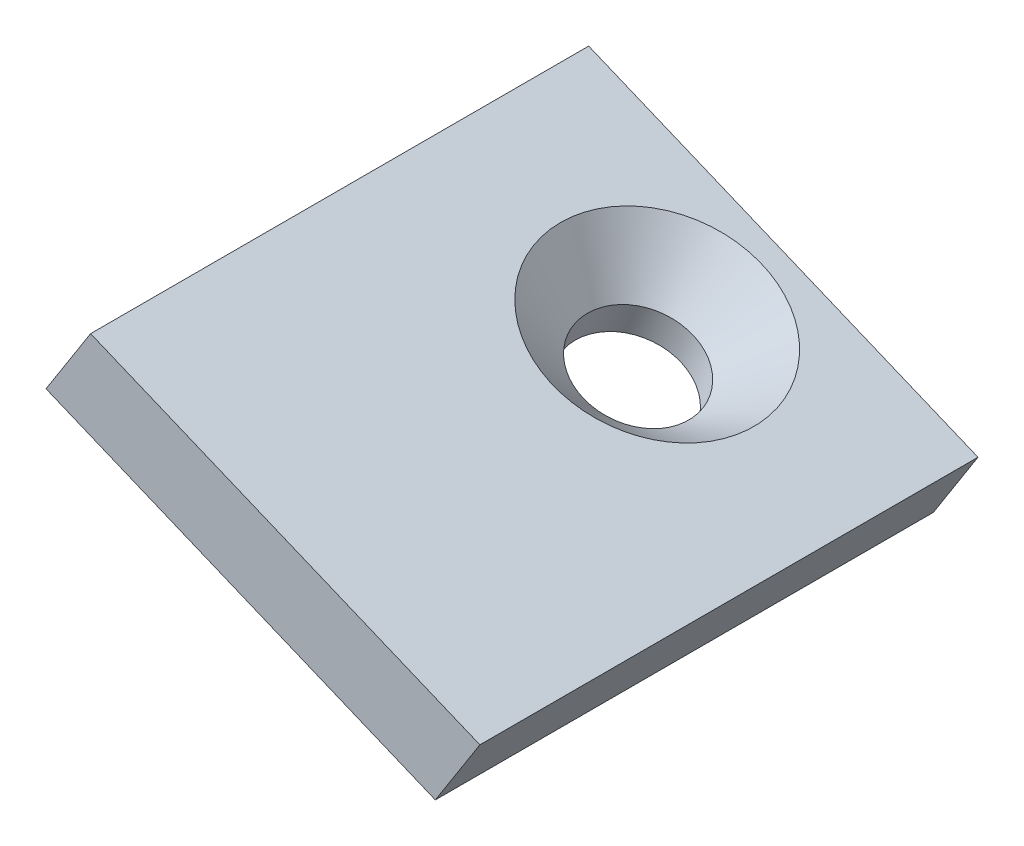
SolidWorks part; units mm, degrees
ref_plane "Plan de face" through (0, 0, 0) normal (0, 0, 1) x (1, 0, 0)
ref_plane "Plan de dessus" through (0, 0, 0) normal (0, 1, 0) x (1, 0, 0)
ref_plane "Plan de droite" through (0, 0, 0) normal (1, 0, 0) x (0, 0, -1)
sketch "Esquisse1" plane through (0, 0, 0) normal (0, 0, 1) x (1, 0, 0)
  line L0 (130.7375, -61.7703) -> (107.2908, -52.0475)
  line L1 (107.2908, -52.0475) -> (109.9762, -47.8298)
  line L2 (109.9762, -47.8298) -> (133.4229, -57.5526)
  line L3 (133.4229, -57.5526) -> (130.7375, -61.7703)
  line L5 (439.8579, 470.2827) -> (107.2908, -52.0475) construction
  line L6 (130.7375, -61.7703) -> (451.5743, 442.1362) construction
  dimension "D2" = 5
extrude "Boss.-Extru.1" add sketch "Esquisse1" along normal blind 30
sketch "Esquisse6" plane through (-0.7873, -1.8987, 0) normal (0.383, 0.9237, 0) x (0.9237, -0.383, 0)
  line L0 (132.6006, 0) -> (132.6006, -30) construction
  line L1 (145.292, 0) -> (119.9092, 0) construction
  line L2 (145.292, -30) -> (119.9092, -30) construction
hole_wizard "Fraisage pour vis à tête fraisée M61" positions "Esquisse7" profile "Esquisse8" countersink size "M6" standard "ISO"
sketch "Esquisse7" plane through (-0.7873, -1.8987, 0) normal (0.383, 0.9237, 0) x (0.9237, -0.383, 0)
  line L0 (132.6006, 0) -> (132.6006, -30) construction
  point P0 (132.6006, -7.5978)
sketch "Esquisse8" plane through (121.6995, -52.6912, 7.5978) normal (0, 0, 1) x (-0.9237, 0.383, 0)
  line L0 (0, 0) -> (0, 13.9059)
  line L1 (0, 13.9059) -> (3.3, 13.9059)
  line L2 (3.3, 13.9059) -> (3.3, 3)
  line L3 (3.3, 3) -> (6.3, 0)
  line L5 (6.3, 0) -> (0, 0)
  line L6 (-3.3, 3) -> (-6.3, 0) construction
  line L11 (0, -6.35) -> (0, 107.95) construction
  dimension "Diamètre du perçage jusqu'au prochain" = 6.6
  dimension "Profondeur du perçage jusqu'au prochain" = 13.9059
  dimension "Diamètre du fraisage entrant" = 12.6
  dimension "Angle du fraisage entrant" = 90
